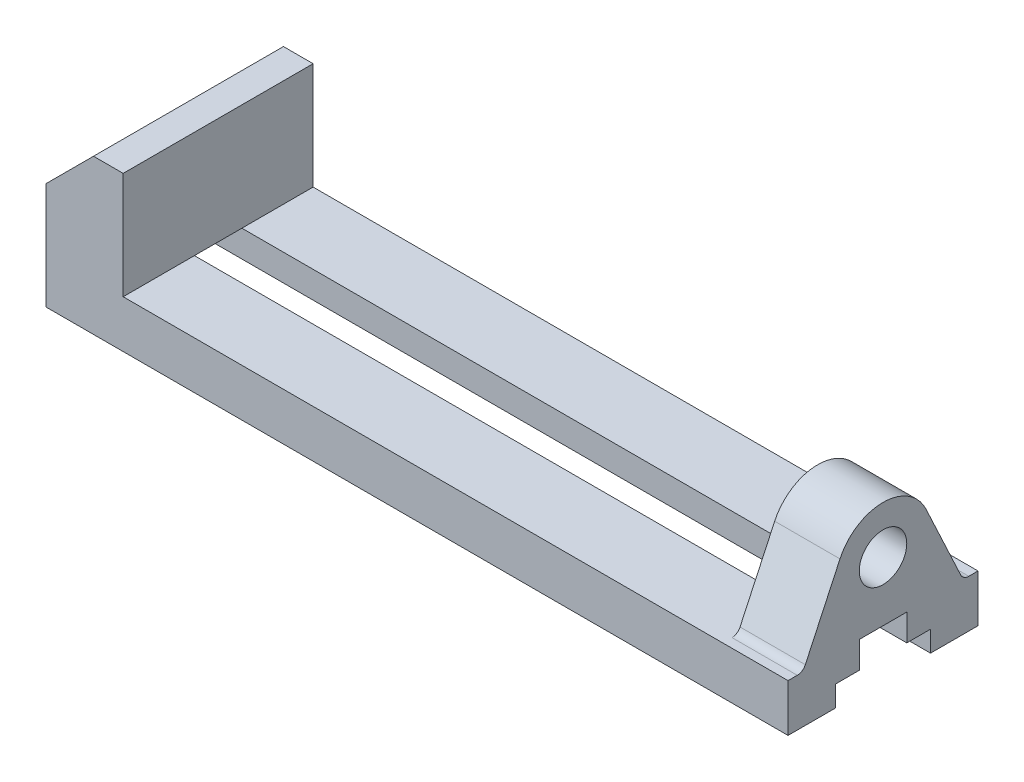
SolidWorks part; units mm, degrees
ref_plane "Front" through (0, 0, 0) normal (0, 0, 1) x (1, 0, 0)
ref_plane "Top" through (0, 0, 0) normal (0, 1, 0) x (1, 0, 0)
ref_plane "Right" through (0, 0, 0) normal (1, 0, 0) x (0, 0, -1)
sketch "Sketch1" plane through (0, 0, 0) normal (0, 0, 1) x (1, 0, 0)
  line L0 (0, 0) -> (250, 0)
  line L1 (250, 0) -> (250, 16)
  line L2 (250, 16) -> (26, 16)
  line L3 (26, 16) -> (26, 52)
  line L4 (26, 52) -> (16, 52)
  line L5 (16, 52) -> (0, 36)
  line L6 (0, 36) -> (0, 0)
  dimension "D1" = 250
  dimension "D2" = 16
  dimension "D3" = 10
  dimension "D4" = 16
  dimension "D5" = 16
  dimension "D6" = 36
extrude "Extrude1" add sketch "Sketch1" along normal mid plane 64
sketch "Sketch2" plane through (250, 0, 0) normal (1, 0, 0) x (0, 0, -1)
  line L0 (14.5009, 42.7619) -> (26.9802, 16)
  line L1 (-32, 52) -> (32, 52) construction
  line L2 (-32, 16) -> (32, 16) construction
  line L3 (0, 52.7641) -> (0, -22.9682) construction
  line L5 (-14.5009, 42.7619) -> (-26.9802, 16)
  line L7 (-26.9802, 16) -> (26.9802, 16)
  arc A1 (14.5009, 42.7619) -> (-14.5009, 42.7619) centre (0, 36) ccw
  dimension "D1" = 16
  dimension "D2" = 50
extrude "Extrude3" add sketch "Sketch2" against normal blind 22
fillet "Fillet1" radius 3 2 edges at (239, 16, -26.9802) (239, 16, 26.9802)
other "Hole1"
sketch "Sketch3" plane through (250, 0, 0) normal (1, 0, 0) x (0, 0, -1)
  circle A0 centre (0, 36) radius 8
  arc A1 (14.5009, 42.7619) -> (-14.5009, 42.7619) centre (0, 36) ccw construction
  dimension "D1" = 16
sketch "Sketch4" plane through (250, 0, 0) normal (1, 0, 0) x (0, 0, -1)
  line L0 (0, 0) -> (0, 54.7774) construction
  line L1 (-16, 0) -> (-16, 7)
  line L2 (-32, 0) -> (32, 0) construction
  line L3 (16, 0) -> (16, 7)
  line L4 (-16, 7) -> (-8, 7)
  line L5 (16, 7) -> (8, 7)
  line L6 (-8, 7) -> (-8, 16)
  line L7 (8, 7) -> (8, 16)
  line L8 (-8, 16) -> (8, 16)
  line L9 (-16, 0) -> (16, 0)
  point P14 (0, 16)
  dimension "D1" = 16
  dimension "D2" = 32
  dimension "D3" = 16
  dimension "D4" = 7
extrude "Cut-Extrude1" cut sketch "Sketch4" against normal through all
ref_plane "Plane1" through (0, 0, 22) normal (0, 0, 1) x (1, 0, 0)
sketch "Sketch6" plane through (0, 0, 22) normal (0, 0, 1) x (1, 0, 0)
  line L0 (212, 26.4839) -> (212, -16.0264) construction
  line L1 (250, 0) -> (250, 16) construction
  line L2 (212, 11.7321) -> (215, 10)
  line L3 (215, 10) -> (215, 0)
  line L4 (0, 0) -> (250, 0) construction
  line L5 (215, 0) -> (212, 0)
  line L6 (212, 0) -> (212, 11.7321)
  dimension "D1" = 38
  dimension "D2" = 6
  dimension "D3" = 10
  dimension "D4" = 60
revolve "Cut-Revolve1" cut sketch "Sketch6" angle 360 about L0
pattern_linear "LPattern2" count 2 spacing 70 along (-1, 0, 0) count 2 spacing 44 along (0, 0, -1) of "Cut-Revolve1"
sketch "Sketch7" plane through (0, 16, 0) normal (0, 1, 0) x (-1, 0, 0)
  ellipse E0 centre (-74.8282, 19.0243) end of major axis (-49.5999, 18.4376) minor radius 4.8493
